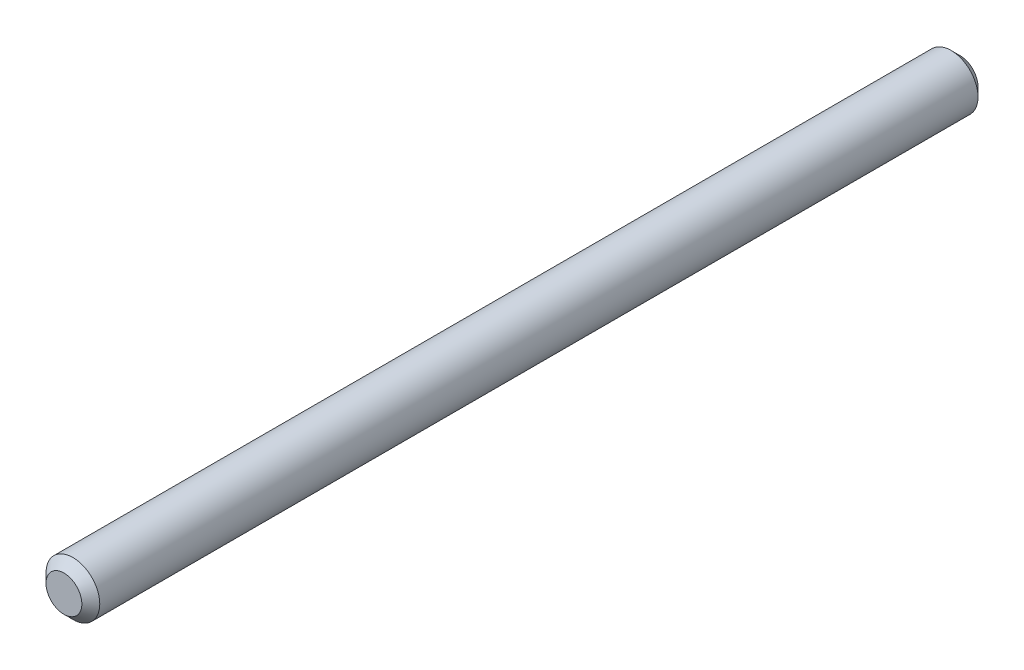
SolidWorks part; units mm, degrees
ref_plane "Face" through (0, 0, 0) normal (0, 0, 1) x (1, 0, 0)
ref_plane "Dessus" through (0, 0, 0) normal (0, 1, 0) x (1, 0, 0)
ref_plane "Droite" through (0, 0, 0) normal (1, 0, 0) x (0, 0, -1)
sketch "Esquisse1" plane through (0, 0, 0) normal (0, 0, 1) x (1, 0, 0)
  circle A0 centre (0, 0) radius 1.5
  dimension "D1" = 3
extrude "Base-Extrusion" add sketch "Esquisse1" along normal mid plane 50
chamfer "Chanfrein1" distance 0.5 angle 45
